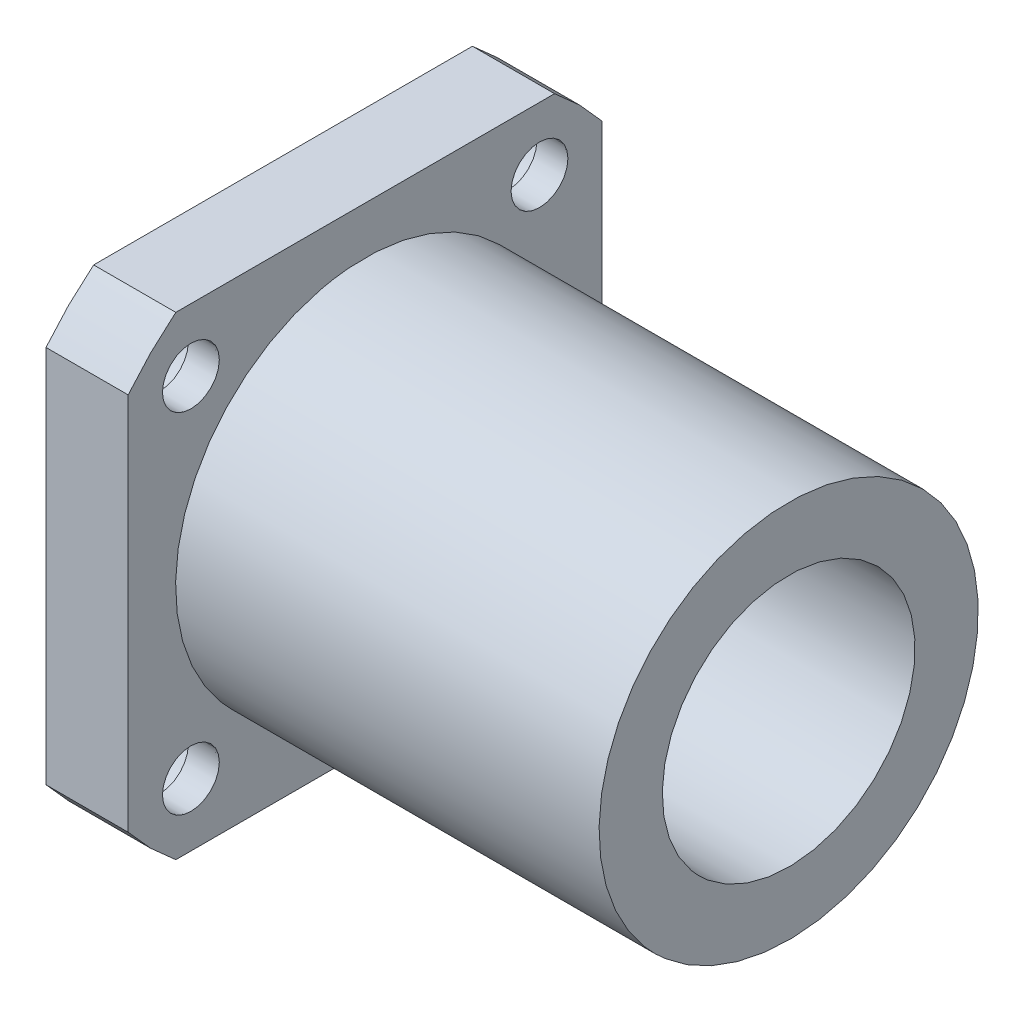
SolidWorks part; units mm, degrees
other "Solid1"
ref_plane "Front Plane" through (0, 0, 0) normal (0, 0, 1) x (1, 0, 0)
ref_plane "Top Plane" through (0, 0, 0) normal (0, 1, 0) x (1, 0, 0)
ref_plane "Right Plane" through (0, 0, 0) normal (1, 0, 0) x (0, 0, -1)
imported_body "2.7054 LMK40UU.stp<1>"
move or copy body "Body-Move/Copy1" bodies to move or copy 101 copy no rotation origin (0, 0, 0) rotation axis (1, 0, 0) rotation angle 45
